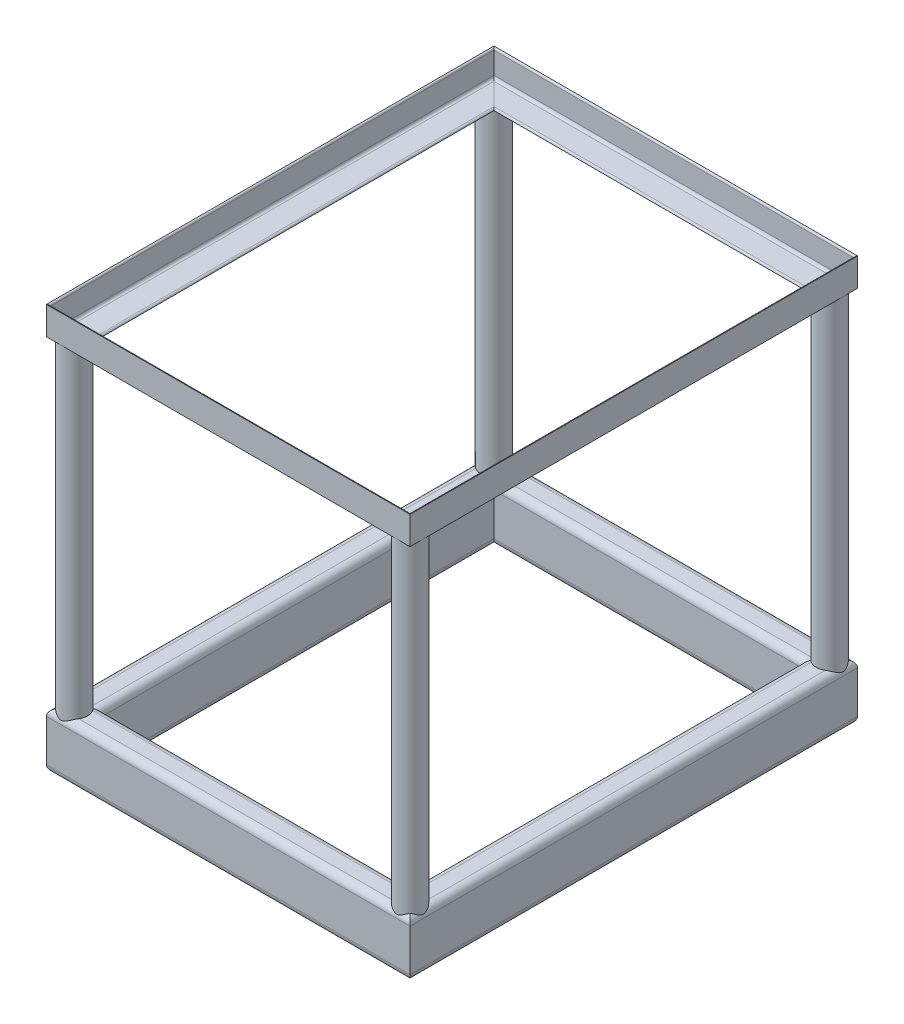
SolidWorks part; units mm, degrees
ref_plane "Front Plane" through (0, 0, 0) normal (0, 0, 1) x (1, 0, 0)
ref_plane "Top Plane" through (0, 0, 0) normal (0, 1, 0) x (1, 0, 0)
ref_plane "Right Plane" through (0, 0, 0) normal (1, 0, 0) x (0, 0, -1)
sketch3d "3DSketch1"
  line L0 (0, 0, 0) -> (609.6, 0, 0)
  line L1 (609.6, 0, 0) -> (609.6, 635, 0)
  line L2 (609.6, 635, 0) -> (0, 635, 0)
  line L3 (0, 635, 0) -> (0, 0, 0)
  line L4 (0, 0, 0) -> (0, 0, 762)
  line L5 (0, 0, 762) -> (0, 635, 762)
  line L6 (0, 635, 762) -> (0, 635, 0)
  line L7 (0, 0, 762) -> (609.6, 0, 762)
  line L8 (609.6, 0, 762) -> (609.6, 0, 0)
  line L9 (0, 635, 762) -> (609.6, 635, 762)
  line L10 (609.6, 635, 762) -> (609.6, 0, 762)
  line L11 (609.6, 635, 762) -> (609.6, 635, 0)
  dimension "D1" = 609.6
  dimension "D2" = 635
  dimension "D3" = 762
other "Structural Member1"
ref_plane "Plane1" through (0, 0, 0) normal (0, 0, 1) x (1, 0, 0)
sketch "Sketch13" plane through (0, 0, 0) normal (0, 0, 1) x (1, 0, 0)
  line L0 (-12.7, -44.45) -> (12.7, -44.45)
  line L1 (-19.05, -38.1) -> (-19.05, 38.1)
  line L2 (12.7, 44.45) -> (-12.7, 44.45)
  line L3 (19.05, 38.1) -> (19.05, -38.1)
  line L4 (-12.7, -50.8) -> (12.7, -50.8)
  line L5 (-25.4, -38.1) -> (-25.4, 38.1)
  line L6 (12.7, 50.8) -> (-12.7, 50.8)
  line L7 (25.4, 38.1) -> (25.4, -38.1)
  line L8 (0, 0) -> (25.4, 0) construction
  line L9 (0, 0) -> (0, 50.8) construction
  arc A0 (25.4, 38.1) -> (12.7, 50.8) centre (12.7, 38.1) ccw
  arc A1 (12.7, -50.8) -> (25.4, -38.1) centre (12.7, -38.1) ccw
  arc A2 (-25.4, -38.1) -> (-12.7, -50.8) centre (-12.7, -38.1) ccw
  arc A3 (-12.7, 50.8) -> (-25.4, 38.1) centre (-12.7, 38.1) ccw
  arc A4 (-12.7, 44.45) -> (-19.05, 38.1) centre (-12.7, 38.1) ccw
  arc A5 (19.05, 38.1) -> (12.7, 44.45) centre (12.7, 38.1) ccw
  arc A6 (12.7, -44.45) -> (19.05, -38.1) centre (12.7, -38.1) ccw
  arc A7 (-19.05, -38.1) -> (-12.7, -44.45) centre (-12.7, -38.1) ccw
  point P3 (0, -50.8)
  point P4 (-25.4, 0)
  point P5 (0, 0)
  point P6 (25.4, -50.8)
  point P7 (-25.4, -50.8)
  point P8 (-25.4, 50.8)
  point P33 (0, 0)
  point P35 (25.4, 50.8)
  point P36 (25.4, 0)
  point P37 (0, 50.8)
  dimension "D1" = 12.7
  dimension "Thickness" = 6.35
  dimension "V_leg" = 101.6
  dimension "H_leg" = 50.8
other "Structural Member2"
ref_plane "Plane2" through (0, 0, 762) normal (0, 1, 0) x (-1, 0, 0)
sketch "Sketch11" plane through (0, 0, 762) normal (0, 1, 0) x (-1, 0, 0)
  circle A0 centre (0, 0) radius 20.447
  circle A1 centre (0, 0) radius 24.13
  circle A2 centre (0, 0) radius 19.05 construction
  point P5 (0, 0)
  dimension "In_dia" = 40.894
  dimension "Out_dia" = 48.26
  dimension "D1" = 38.1
other "Structural Member3"
ref_plane "Plane3" through (0, 635, 762) normal (1, 0, 0) x (0, 0, -1)
sketch "Sketch12" plane through (0, 635, 787.4) normal (1, 0, 0) x (0, 0, -1)
  line L0 (0, 0) -> (0, 50.8)
  line L1 (0, 50.8) -> (0.0051, 50.8)
  line L2 (3.175, 47.6301) -> (3.175, 7.9375)
  line L3 (7.9375, 3.175) -> (47.6301, 3.175)
  line L4 (50.8, 0.0051) -> (50.8, 0)
  line L5 (50.8, 0) -> (0, 0)
  arc A0 (50.8, 0.0051) -> (47.6301, 3.175) centre (47.6301, 0.0051) ccw
  arc A1 (0.0051, 50.8) -> (3.175, 47.6301) centre (0.0051, 47.6301) cw
  arc A2 (7.9375, 3.175) -> (3.175, 7.9375) centre (7.9375, 7.9375) cw
  point P10 (25.4, 0)
  point P14 (0, 25.4)
  point P15 (3.175, 25.4)
  point P16 (25.4, 3.175)
  point P17 (3.175, 50.8)
  point P18 (50.8, 3.175)
  point P19 (0, 0)
  dimension "D2" = 0.0051
  dimension "Radius_1" = 4.7625
  dimension "D1" = 3.175
  dimension "H_leg" = 50.8
